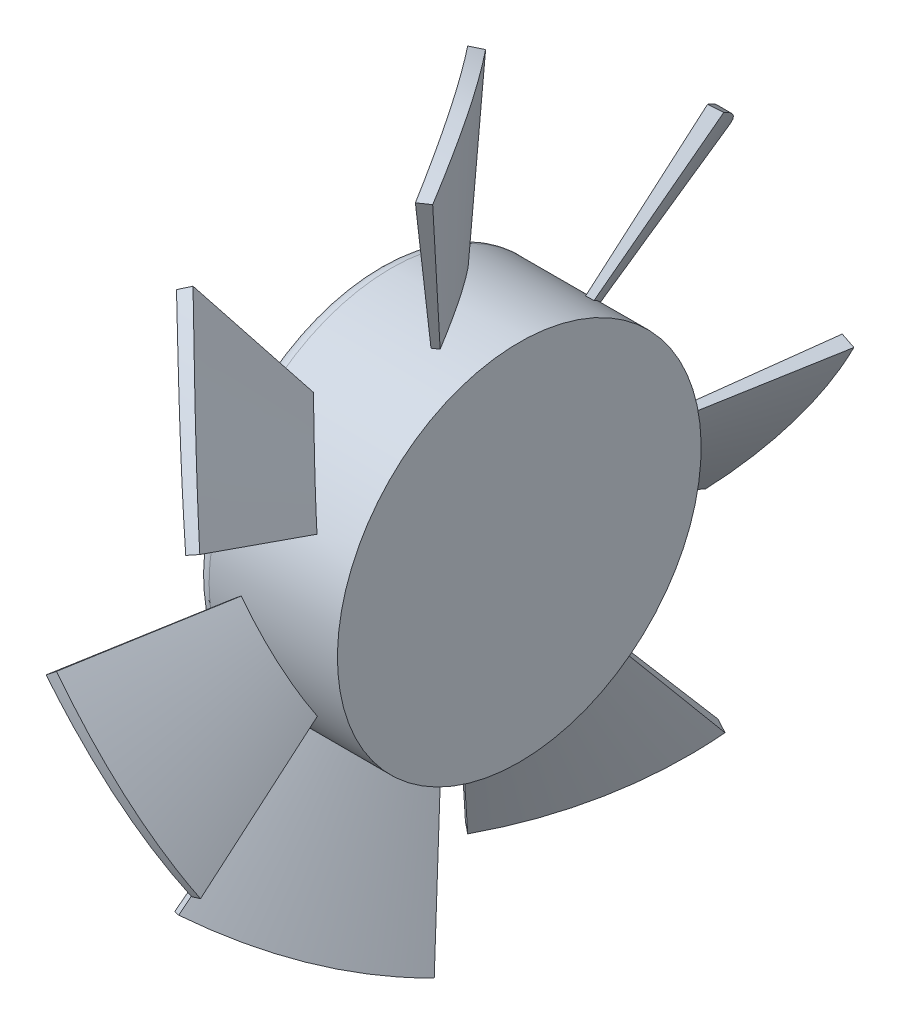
SolidWorks part; units mm, degrees
ref_plane "Front" through (0, 0, 0) normal (0, 0, 1) x (1, 0, 0)
ref_plane "Top" through (0, 0, 0) normal (0, 1, 0) x (1, 0, 0)
ref_plane "Right" through (0, 0, 0) normal (1, 0, 0) x (0, 0, -1)
sketch "Support-Front" plane through (0, 0, 0) normal (0, 0, 1) x (1, 0, 0)
  line L0 (-25.4, 0) -> (-4, 0) construction
  line L1 (-25.4, -27.5) -> (-25.4, 27.5)
  line L2 (-25.4, 27.5) -> (-4, 27.5)
  line L3 (-25.4, -27.5) -> (-4, -27.5)
  line L4 (-4, 27.5) -> (-4, -27.5)
  line L5 (-14.7, 27.5) -> (-14.7, -27.5) construction
  line L6 (-4, 27.5) -> (0, 27.5) construction
  line L7 (-4, -27.5) -> (0, -27.5) construction
  line L8 (0, 27.5) -> (0, -27.5) construction
  line L10 (-25.4, 7.1277) -> (-25.1511, 7.1277)
  line L11 (-14.7, 27.5) -> (-14.7, 52) construction
  line L12 (-14.7, -27.5) -> (-14.7, -52) construction
  line L13 (-25.1511, 7.1277) -> (-25.1511, -7.1277)
  line L14 (-25.4, -7.1277) -> (-25.1511, -7.1277)
  line L15 (-25.4, 0) -> (-25.1511, 7.1277) construction
  line L16 (-25.4, 27.5) -> (-25.1511, 7.1277) construction
  point P12 (0, 0)
  point P14 (-14.7, 0)
  point P20 (-25.1511, 0)
  dimension "D1" = 2
  dimension "Width" = 25.4
  dimension "D2" = 0.7
  dimension "Diam-Body" = 55
  dimension "Diam-Fan" = 104
  dimension "Dist-Fan" = 4
sketch "Support-Right" plane through (0, 0, 0) normal (1, 0, 0) x (0, 0, -1)
  circle A0 centre (0, 0) radius 52
sketch "Support-Fan-Blade-Top" plane through (0, 0, 0) normal (0, 1, 0) x (-1, 0, 0)
  line L0 (14.7, 0) -> (6.9286, 12.9338) construction
  line L1 (23.7808, -12.0506) -> (6.9286, 12.9338) construction
  line L2 (15.3547, 0.4416) -> (14.7, 0) construction
  line L4 (25.4, 0) -> (6.9286, 12.9338) construction
  line L5 (25.4, 0) -> (4, 0) construction
  line L6 (5.1627, 11.9949) -> (6.9286, 12.9338)
  line L7 (22.2487, -13.3362) -> (23.7808, -12.0506)
  arc A0 (6.9286, 12.9338) -> (23.7808, -12.0506) centre (134.2104, 80.6108) ccw
  arc A1 (5.1627, 11.9949) -> (22.2487, -13.3362) centre (134.2104, 80.6108) ccw
  dimension "D2" = 2
  dimension "D1" = 3
  dimension "D3" = 35
  dimension "Angle-Fan-Blade" = 56
ref_plane "Plane-Angle-Fan-Blade" through (-10.1034, 0, 6.8148) normal (-0.829, 0, 0.5592) x (0.5592, 0, 0.829)
ref_plane "Plane-Top-Fan-Blade" through (0, 52, 0) normal (0, 1, 0) x (-1, 0, 0)
sketch "Sketch-Blade-Bottom" plane through (0, 0, 0) normal (0, 1, 0) x (1, 0, 0)
  point P0 (-14.7, 0)
sketch "Sketch-Blade-Top" plane through (0, 52, 0) normal (0, 1, 0) x (-1, 0, 0)
  line L2 (6.9286, 12.9338) -> (5.1627, 11.9949)
  line L3 (22.2487, -13.3362) -> (23.7808, -12.0506)
  line L4 (6.9286, 12.9338) -> (5.1627, 11.9949)
  line L5 (22.2487, -13.3362) -> (23.7808, -12.0506)
  arc A3 (5.1627, 11.9949) -> (22.2487, -13.3362) centre (134.2104, 80.6108) ccw
  arc A4 (6.9286, 12.9338) -> (23.7808, -12.0506) centre (134.2104, 80.6108) ccw
  arc A5 (5.1627, 11.9949) -> (22.2487, -13.3362) centre (134.2104, 80.6108) ccw
  arc A6 (6.9286, 12.9338) -> (23.7808, -12.0506) centre (134.2104, 80.6108) ccw
  dimension "D1" = 0
ref_plane "Plane-Right-Cut" through (-25.4, 0, 0) normal (1, 0, 0) x (0, 0, -1)
sketch "Sketch5" plane through (0, 0, 0) normal (0, 0, 1) x (1, 0, 0)
  line L4 (-25.4, 27.5) -> (-4, 27.5) construction
  line L6 (-25.4, 7.1277) -> (-25.1511, 7.1277) construction
  line L12 (-25.1511, 7.1277) -> (-25.1511, -7.1277) construction
  line L13 (-25.4, -27.5) -> (-25.4, 27.5) construction
  line L14 (-4, 27.5) -> (-4, -27.5) construction
  line L15 (-25.4, 0) -> (-4, 0) construction
  line L16 (-25.4, 27.5) -> (-4, 27.5)
  line L17 (-25.4, 7.1277) -> (-25.1511, 7.1277)
  line L18 (-25.1511, 7.1277) -> (-25.1511, 0)
  line L19 (-25.4, 7.1277) -> (-25.4, 27.5)
  line L20 (-4, 27.5) -> (-4, 0)
  line L21 (-25.1511, 0) -> (-4, 0) construction
  line L22 (-25.1511, 0) -> (-4, 0)
revolve "Body" add sketch "Sketch5" angle 360 about L21
loft "Loft-Fan-Blade" add profiles "Sketch-Blade-Top", "Sketch-Blade-Bottom"
pattern_circular "CirPattern1" count 7 over 360 about axis through (-25.1511, 0, 0) along (1, 0, 0)
sketch "Sketch-Cut-Blade" plane through (0, 0, 0) normal (1, 0, 0) x (0, 0, -1)
  circle A0 centre (0, 0) radius 52 construction
  circle A1 centre (0, 0) radius 52
extrude "Cut-Fan-Blade" cut sketch "Sketch-Cut-Blade" against normal through all flip side to cut
fillet "Cosmetic-Fillet" radius 2
equation "\"Angle-Blade@Plane-Angle-Fan-Blade\" = \"Angle-Fan-Blade@Support-Fan-Blade-Top\""
equation "\"Rad@Cosmetic-Fillet\" = \"Dist-Fan@Support-Front\" / 2"
